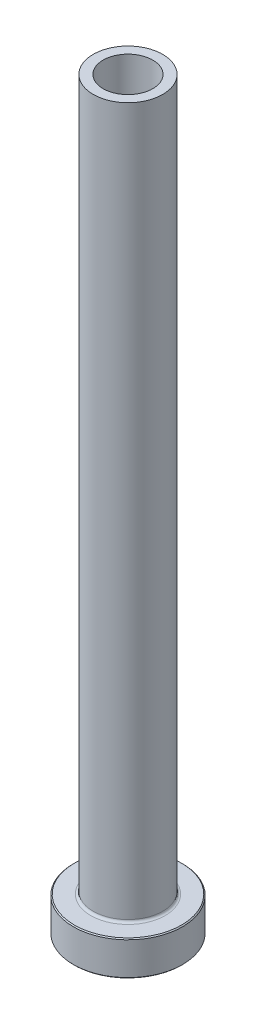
SolidWorks part; units mm, degrees
ref_plane "Front Plane" through (0, 0, 0) normal (0, 0, 1) x (1, 0, 0)
ref_plane "Top Plane" through (0, 0, 0) normal (0, 1, 0) x (1, 0, 0)
ref_plane "Right Plane" through (0, 0, 0) normal (1, 0, 0) x (0, 0, -1)
sketch "Sketch1" plane through (0, 0, 0) normal (0, 0, 1) x (1, 0, 0)
  line L0 (-5, 150) -> (-7, 150)
  line L1 (-7, 150) -> (-7, 7)
  line L2 (-7, 7) -> (-11, 7)
  line L3 (-11, 7) -> (-11, 0)
  line L4 (12.1, 0) -> (-12.1, 0) construction
  line L5 (-11, 0) -> (-5.25, 0)
  line L6 (-5, 105) -> (-5, 150)
  line L7 (0, 92.1877) -> (0, -15.5353) construction
  line L8 (0, -12.1) -> (0, 12.1) construction
  line L9 (-5, 105) -> (-5.25, 93)
  line L10 (-5.25, 93) -> (-5.25, 0)
  dimension "D1" = 0.25
  dimension "ID" = 10
  dimension "OD" = 14
  dimension "L" = 150
  dimension "H" = 22
  dimension "T" = 7
  dimension "N" = 45
  dimension "D2" = 12
revolve "Revolve1" add sketch "Sketch1" angle 360 about L7
fillet "Fillet1" radius 0.5 1 edges at (0, 7, 7)
chamfer "Chamfer1" distance 0.2 angle 45 2 edges at (0, 7, 11) (0, 0, 11)
chamfer "Chamfer3" distance 0.5 angle 45 1 edges at (0, 0, 5.25)
